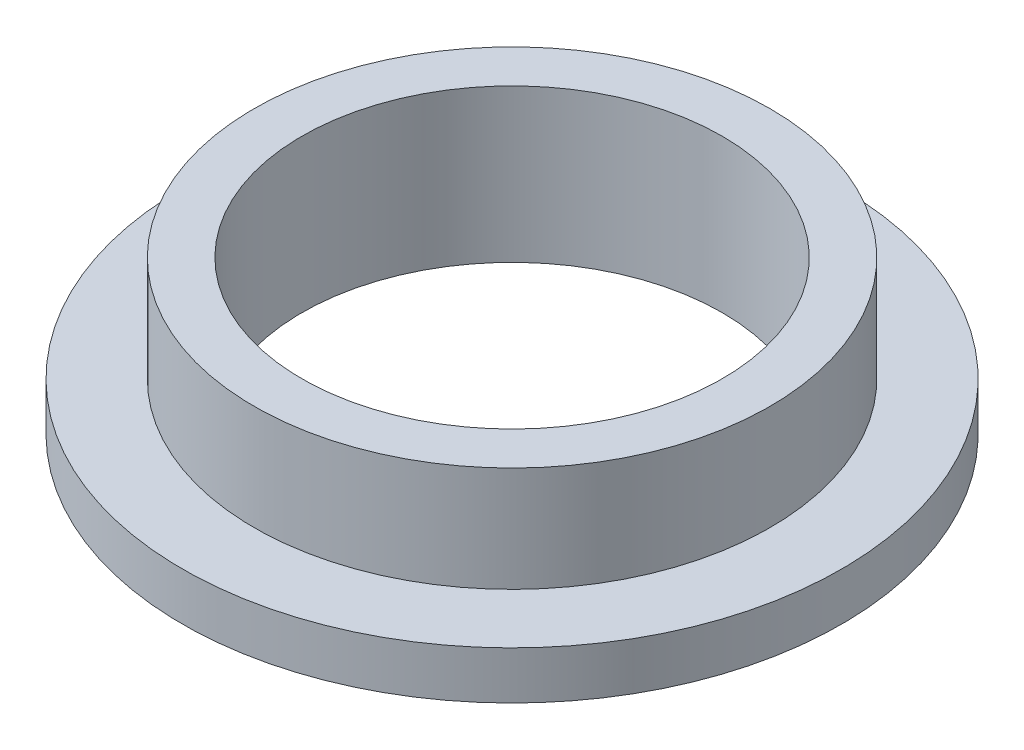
SolidWorks part; units mm, degrees
ref_plane "Plan de face" through (0, 0, 0) normal (0, 0, 1) x (1, 0, 0)
ref_plane "Plan de dessus" through (0, 0, 0) normal (0, 1, 0) x (1, 0, 0)
ref_plane "Plan de droite" through (0, 0, 0) normal (1, 0, 0) x (0, 0, -1)
sketch "Esquisse1" plane through (0, 0, 0) normal (0, 0, 1) x (1, 0, 0)
  line L0 (0, 0) -> (0, 4.0166) construction
  line L1 (3.45, 0) -> (2.2, 0)
  line L2 (2.2, 0) -> (2.2, 1.6)
  line L3 (2.2, 1.6) -> (2.7, 1.6)
  line L4 (2.7, 1.6) -> (2.7, 0.5)
  line L5 (2.7, 0.5) -> (3.45, 0.5)
  line L6 (3.45, 0.5) -> (3.45, 0)
  dimension "D1" = 4.4
  dimension "D2" = 6.9
  dimension "D3" = 0.5
  dimension "D4" = 0.5
  dimension "D5" = 1.6
revolve "Révolution1" add sketch "Esquisse1" angle 360 about L0
